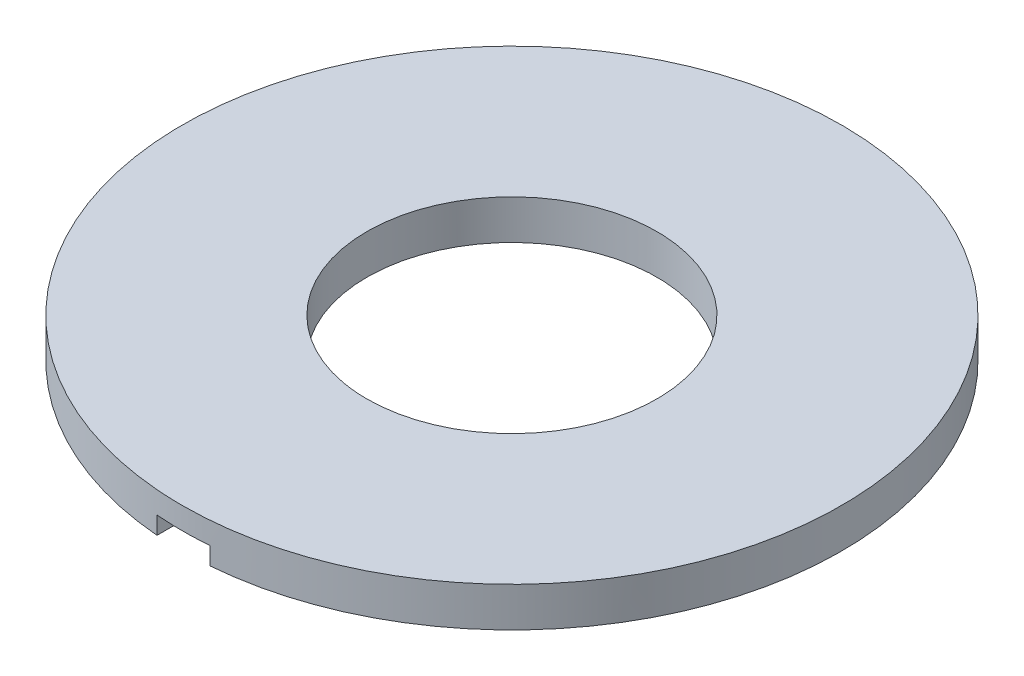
SolidWorks part; units mm, degrees
ref_plane "Front Plane" through (0, 0, 0) normal (0, 0, 1) x (1, 0, 0)
ref_plane "Top Plane" through (0, 0, 0) normal (0, 1, 0) x (1, 0, 0)
ref_plane "Right Plane" through (0, 0, 0) normal (1, 0, 0) x (0, 0, -1)
sketch "Sketch1" plane through (0, 0, 0) normal (0, 1, 0) x (1, 0, 0)
  circle A0 centre (0, 0) radius 1.1
  circle A1 centre (0, 0) radius 2.5
  dimension "D1" = 2.2
  dimension "D2" = 5
extrude "Extrude1" add sketch "Sketch1" along normal blind 0.3
sketch "Sketch2" plane through (0, 0, 0) normal (0, -1, 0) x (1, 0, 0)
  line L1 (-0.2, -0.3) -> (0.2, -0.3)
  line L2 (-0.2, -0.3) -> (-0.2, 2.5)
  line L3 (-0.2, 2.5) -> (0.2, 2.5)
  line L4 (0.2, -0.3) -> (0.2, 2.5)
  line L5 (-0.2, -0.3) -> (0.2, 2.5) construction
  line L6 (-0.2, 2.5) -> (0.2, -0.3) construction
  circle A0 centre (0, 0) radius 1.1 construction
  circle A1 centre (0, 0) radius 2.5 construction
  point P0 (0, 1.1)
  dimension "D1" = 0.4
extrude "Cut-Extrude1" cut sketch "Sketch2" against normal blind 0.1333
